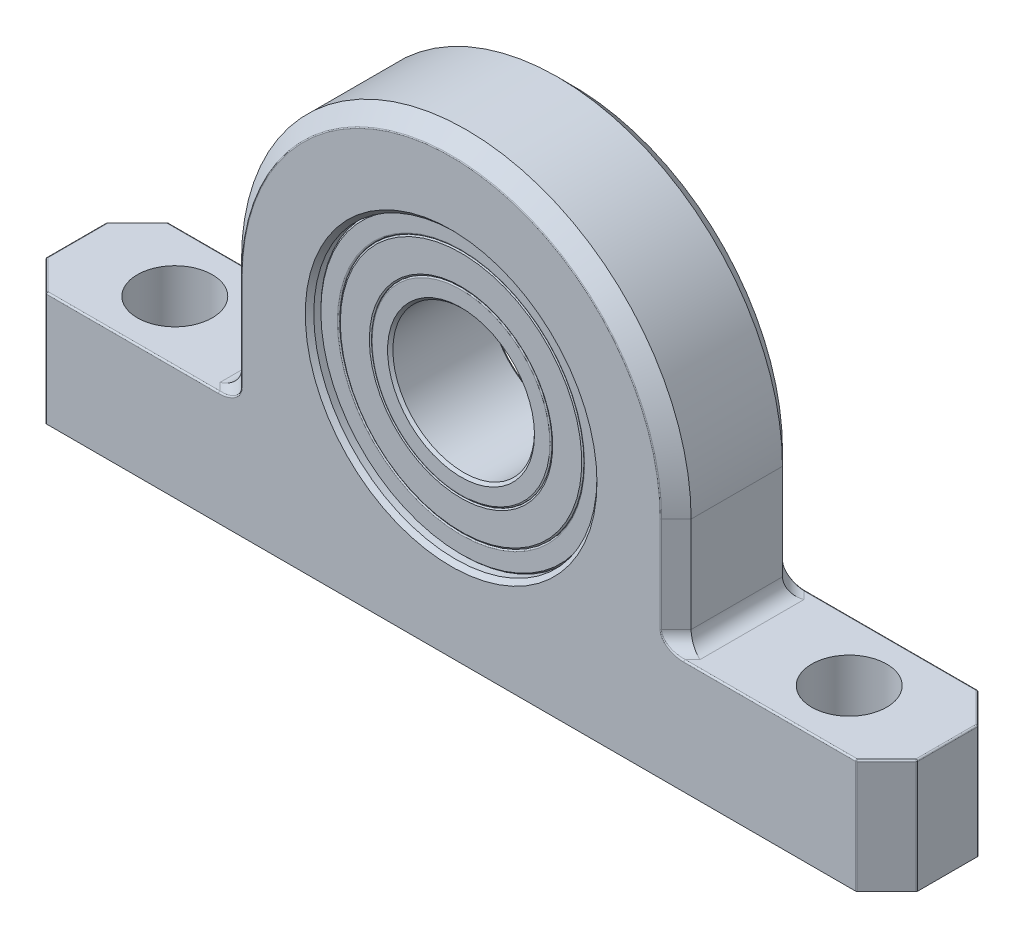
SolidWorks part; units mm, degrees
ref_plane "Front Plane" through (0, 0, 0) normal (0, 0, 1) x (1, 0, 0)
ref_plane "Top Plane" through (0, 0, 0) normal (0, 1, 0) x (1, 0, 0)
ref_plane "Right Plane" through (0, 0, 0) normal (1, 0, 0) x (0, 0, -1)
sketch "Sketch1" plane through (0, 0, 0) normal (0, 0, 1) x (1, 0, 0)
  line L0 (9.525, 0) -> (9.525, -4.699)
  line L1 (9.525, -4.699) -> (18.4547, -4.699)
  line L2 (18.4547, -4.699) -> (18.4547, -9.525)
  line L3 (18.4547, -9.525) -> (-18.4547, -9.525)
  line L4 (-18.4547, -9.525) -> (-18.4547, -4.699)
  line L5 (-18.4547, -4.699) -> (-9.525, -4.699)
  line L6 (-9.525, -4.699) -> (-9.525, 0)
  circle A0 centre (0, 0) radius 3
  arc A1 (9.525, 0) -> (-9.525, 0) centre (0, 0) ccw
  circle A2 centre (0, 0) radius 6
  point P12 (0, 6)
  point P13 (0, 3)
sketch "Sketch2" plane through (0, 0, 0) normal (0, 1, 0) x (1, 0, 0)
  line L0 (0, 2.5797) -> (0, -2.5797) construction
  line L1 (-14.2875, 0) -> (14.2875, 0) construction
  circle A0 centre (14.2875, 0) radius 1.5875 construction
  circle A1 centre (-14.2875, 0) radius 1.5875 construction
sketch "Sketch3" plane through (0, 0, 0) normal (0, 0, 1) x (1, 0, 0)
  line L0 (9.525, 0) -> (9.525, -4.699) construction
  line L1 (18.4547, -4.699) -> (18.4547, -9.525) construction
  line L2 (9.525, -4.699) -> (18.4547, -4.699) construction
  line L3 (18.4547, -9.525) -> (-18.4547, -9.525) construction
  line L4 (-18.4547, -9.525) -> (-18.4547, -4.699) construction
  line L5 (-18.4547, -4.699) -> (-9.525, -4.699) construction
  line L6 (-9.525, -4.699) -> (-9.525, 0) construction
  line L7 (9.525, 0) -> (9.525, -4.699)
  line L8 (18.4547, -4.699) -> (18.4547, -9.525)
  line L9 (9.525, -4.699) -> (18.4547, -4.699)
  line L10 (18.4547, -9.525) -> (-18.4547, -9.525)
  line L11 (-18.4547, -9.525) -> (-18.4547, -4.699)
  line L12 (-18.4547, -4.699) -> (-9.525, -4.699)
  line L13 (-9.525, -4.699) -> (-9.525, 0)
  arc A0 (9.525, 0) -> (-9.525, 0) centre (0, 0) ccw construction
  circle A1 centre (0, 0) radius 6 construction
  arc A2 (9.525, 0) -> (-9.525, 0) centre (0, 0) ccw
  circle A3 centre (0, 0) radius 6
extrude "Extrude1" add sketch "Sketch3" along normal up to vertex and the other way up to vertex
sketch "Sketch4" plane through (0, -4.699, 0) normal (0, 1, 0) x (1, 0, 0)
  line L0 (-18.4547, 2.5797) -> (-18.4547, 1.2898)
  line L1 (-18.4547, -2.5797) -> (-18.4547, 2.5797) construction
  line L2 (-18.4547, 1.2898) -> (-17.1648, 2.5797)
  line L3 (-9.525, 2.5797) -> (-18.4547, 2.5797) construction
  line L4 (-17.1648, 2.5797) -> (-18.4547, 2.5797)
  line L5 (0, 0) -> (0, 2.5797) construction
  line L6 (0, 0) -> (-14.2875, 0) construction
  line L7 (17.1648, 2.5797) -> (18.4547, 2.5797)
  line L8 (18.4547, 1.2898) -> (17.1648, 2.5797)
  line L9 (18.4547, 2.5797) -> (18.4547, 1.2898)
  line L10 (18.4547, -2.5797) -> (18.4547, -1.2898)
  line L11 (18.4547, -1.2898) -> (17.1648, -2.5797)
  line L12 (17.1648, -2.5797) -> (18.4547, -2.5797)
  line L13 (-17.1648, -2.5797) -> (-18.4547, -2.5797)
  line L14 (-18.4547, -1.2898) -> (-17.1648, -2.5797)
  line L15 (-18.4547, -2.5797) -> (-18.4547, -1.2898)
  circle A0 centre (-14.2875, 0) radius 1.5875 construction
  circle A1 centre (14.2875, 0) radius 1.5875 construction
  circle A2 centre (-14.2875, 0) radius 1.5875
  circle A3 centre (14.2875, 0) radius 1.5875
extrude "Cut-Extrude1" cut sketch "Sketch4" against normal through all
chamfer "Chamfer3" distance 0.6449 angle 45 6 edges at (-9.525, -2.3495, -2.5797) (0, 9.525, -2.5797) (9.525, -2.3495, -2.5797) (-9.525, -2.3495, 2.5797) (0, 9.525, 2.5797) (9.525, -2.3495, 2.5797)
fillet "Fillet6" radius 0.6449 6 edges at (9.525, -4.699, 0) (9.2025, -4.699, -2.2572) (9.2025, -4.699, 2.2572) (-9.2025, -4.699, -2.2572) (-9.2025, -4.699, 2.2572) (-9.525, -4.699, 0)
fillet "Fillet7" radius 0.0645 28 edges at (13.4785, -4.699, -2.5797) (9.1472, -4.5101, -2.5797) (8.8801, -2.027, -2.5797) (0, 8.8801, -2.5797) (-8.8801, -2.027, -2.5797) (-9.1472, -4.5101, -2.5797) (13.4785, -4.699, 2.5797) (9.1472, -4.5101, 2.5797) (8.8801, -2.027, 2.5797) (0, 8.8801, 2.5797) (-8.8801, -2.027, 2.5797) (-9.1472, -4.5101, 2.5797) (17.8098, -4.699, 1.9348) (18.4547, -4.699, 0) (17.8098, -4.699, -1.9348) (-13.4785, -4.699, -2.5797) (-17.8098, -4.699, -1.9348) (-18.4547, -4.699, 0) (-17.8098, -4.699, 1.9348) (-13.4785, -4.699, 2.5797) (-18.4547, -7.112, -1.2898) (-17.1648, -7.112, -2.5797) (-18.4547, -7.112, 1.2898) (-17.1648, -7.112, 2.5797) (17.1648, -7.112, -2.5797) (18.4547, -7.112, -1.2898) (18.4547, -7.112, 1.2898) (17.1648, -7.112, 2.5797)
chamfer "Chamfer4" distance 0.18 angle 45 2 edges at (6, 0, -2.5797) (6, 0, 2.5797)
sketch "Sketch5" plane through (0, 0, 0) normal (1, 0, 0) x (0, 0, -1)
  line L2 (2.1597, 6) -> (2.1597, 5.175)
  line L4 (2.1597, 5.175) -> (-2.1597, 5.175)
  line L8 (-2.1597, 3) -> (2.1597, 3)
  line L9 (2.1597, 3.825) -> (-2.1597, 3.825)
  line L10 (-2.1597, 6) -> (2.1597, 6)
  line L12 (-2.1597, 3.825) -> (-2.1597, 3)
  line L13 (-2.1597, 6) -> (-2.1597, 5.175)
  line L17 (0, 6) -> (0, 9.525) construction
  line L18 (0, 9.525) -> (0, 0) construction
  line L24 (2.1597, 3.825) -> (2.1597, 3)
  line L27 (1.9348, 9.525) -> (-1.9348, 9.525) construction
revolve "Revolve1" add sketch "Sketch5" angle 360 about L0
sketch "Sketch6" plane through (0, 0, 0) normal (1, 0, 0) x (0, 0, -1)
  line L9 (2.1597, 3.825) -> (-2.1597, 3.825) construction
  line L10 (0, 0) -> (0, 2.6695) construction
  line L19 (0, 0) -> (1.2184, 0) construction
  line L21 (-2.1597, 5.175) -> (-1.6198, 5.175)
  line L23 (-2.1597, 5.175) -> (-2.1597, 3.825)
  line L24 (-2.1597, 3.825) -> (-1.6198, 3.825)
  line L25 (-1.6198, 5.175) -> (-1.6198, 3.825)
  line L27 (2.1597, 5.175) -> (1.6198, 5.175)
  line L28 (2.1597, 5.175) -> (2.1597, 3.825)
  line L29 (2.1597, 3.825) -> (1.6198, 3.825)
  line L30 (1.6198, 5.175) -> (1.6198, 3.825)
revolve "Revolve2" add sketch "Sketch6" angle 360 about L19
chamfer "Chamfer5" distance 0.1125 angle 45 2 edges at (-3, 0, 2.1597) (-3, 0, -2.1597)
fillet "Fillet8" radius 0.06 2 edges at (-3.825, 0, -2.1597) (-3.825, 0, 2.1597)
fillet "Fillet9" radius 0.06 2 edges at (-5.175, 0, -2.1597) (-5.175, 0, 2.1597)
chamfer "Chamfer6" distance 0.06 angle 45 2 edges at (-6, 0, -2.1597) (-6, 0, 2.1597)
chamfer "Chamfer7" distance 0.06 angle 30 2 edges at (5.175, 0, 2.1597) (3.825, 0, 2.1597)
chamfer "Chamfer8" distance 0.06 angle 30 2 edges at (5.175, 0, -2.1597) (3.825, 0, -2.1597)
sketch "Sketch7" plane through (0, 0, 2.5797) normal (0, 0, 1) x (1, 0, 0)
  line L0 (0, -1000) -> (0, 49000) construction
equation "\"D2@Sketch4\" = \"Overall Width@Sketch2\" / 4"
equation "\"D1@Chamfer3\"=\"Overall Width@Sketch2\" / 8"
equation "\"D1@Fillet6\"=\"D1@Chamfer3\""
equation "\"D3@Sketch5\"=(\"Overall Width@Sketch2\"-2*\"D1@Chamfer4\")*.9"
equation "\"D1@Chamfer5\"=\"ID@Sketch1\"*.01875"
equation "\"D1@Fillet8\"=\"ID@Sketch1\"*.01"
equation "\"D1@Fillet9\"=\"Bearing OD@Sketch1\"*.005"
equation "\"D1@Chamfer6\"=\"Bearing OD@Sketch1\"*.005"
equation "\"D1@Chamfer4\"=\"Bearing OD@Sketch1\"*.015"
equation "\"D1@Fillet7\"=\"Overall Width@Sketch2\"*.0125"
equation "\"D2@Sketch5\"=(\"Bearing OD@Sketch1\"-\"ID@Sketch1\")/2*.45"
equation "\"D1@Sketch6\"=\"D3@Sketch5\"/8"
equation "\"D1@Chamfer7\"=\"ID@Sketch1\"*.01"
equation "\"D1@Chamfer8\"=\"ID@Sketch1\"*.01"
